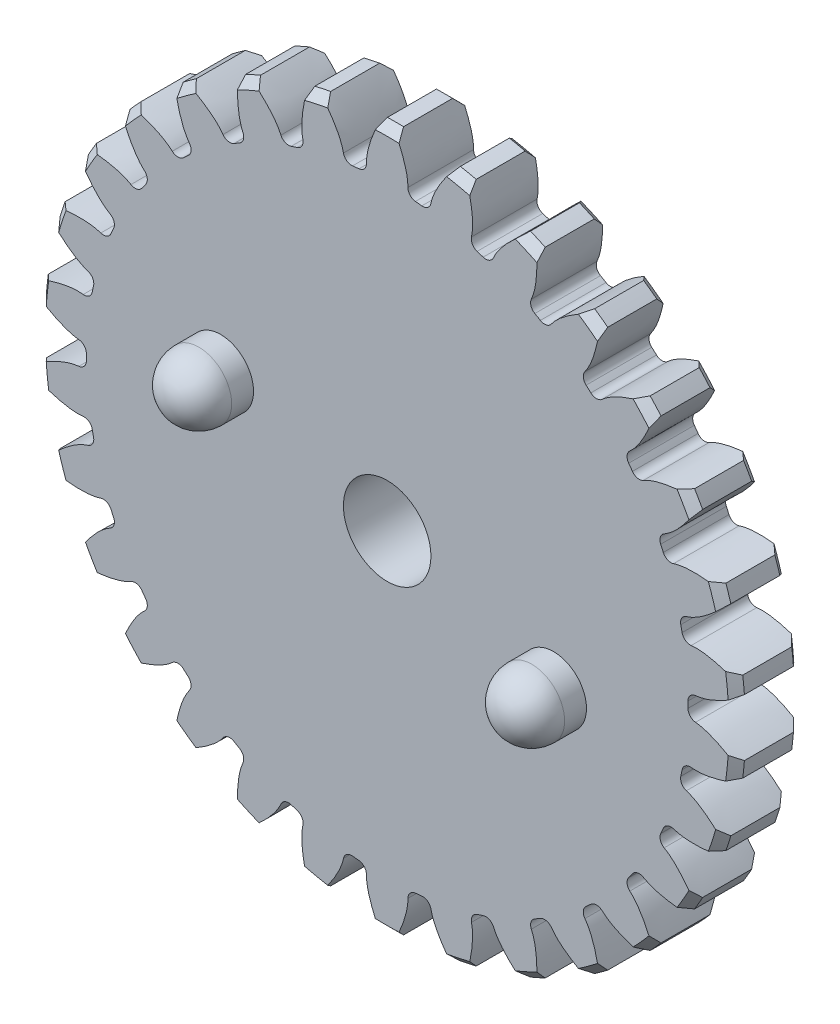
SolidWorks part; units mm, degrees
ref_plane "Plan1" through (0, 0, 0) normal (0, 0, 1) x (1, 0, 0)
ref_plane "Plan2" through (0, 0, 0) normal (0, 1, 0) x (1, 0, 0)
ref_plane "Plan3" through (0, 0, 0) normal (1, 0, 0) x (0, 0, -1)
sketch "Dent" plane through (0, 0, 0) normal (0, 0, 1) x (1, 0, 0)
  line L1 (-0.1845, 6.0656) -> (0, 5.5586)
  line L3 (0, 8) -> (0, -8) construction
  line L4 (0, 0) -> (0.1845, 7.9979) construction
  line L5 (0.3927, 7.4897) -> (-0.3927, 7.4897) construction
  line L6 (0.4739, 7.0317) -> (-0.4739, 7.0317) construction
  line L7 (-0.25, 0) -> (0.25, 0) construction
  line L9 (0.1845, 6.0656) -> (0, 5.5586)
  line L11 (0, 0) -> (0.3927, 7.4897) construction
  line L12 (0, 0) -> (0.4739, 7.0317) construction
  circle A0 centre (0, 0) radius 7.5 construction
  circle A1 centre (0, 0) radius 8 construction
  arc A2 (0.1845, 7.9979) -> (-0.1845, 7.9979) centre (0, 0) ccw
  circle A3 centre (0, 0) radius 7.0477 construction
  point P2 (-0.3927, 7.4897)
  point P3 (-0.4739, 7.0317)
  point P19 (0.3927, 7.4897)
  point P20 (0.4739, 7.0317)
sketch "Esquisse2" plane through (0, 0, 0) normal (0, 0, 1) x (1, 0, 0)
  circle A0 centre (0, 0) radius 6.875
extrude "Base-Extrusion" add sketch "Esquisse2" against normal blind 1.5
extrude "Boss.-Extru.1" add sketch "Dent" against normal blind 1.5
fillet "Congé1" radius 0.19 4 edges at (0.4582, 6.8597, -0.75) (-0.4588, 6.8597, -0.75)
chamfer "Chanfrein1" distance 0.19 angle 45 4 edges at (0, 8, -1.5) (0, 8, 0)
pattern_circular "Répétition circulaire1" count 30 over 360 of "Congé1", "Boss.-Extru.1", "Chanfrein1"
sketch "Esquisse3" plane through (0, 0, 0) normal (0, 0, 1) x (1, 0, 0)
  circle A0 centre (0, 0) radius 1
  dimension "D1" = 2
extrude "Enlèv. mat.-Extru.1" cut sketch "Esquisse3" against normal through all
sketch "Esquisse4" plane through (0, 0, 0) normal (0, 0, 1) x (1, 0, 0)
  line L0 (-7.6064, 2.4715) -> (10.4409, -3.3925) construction
  line L1 (-7.5494, 2.647) -> (-7.6634, 2.296) construction
  line L2 (0, 0) -> (1.5766, 4.8522) construction
  circle A1 centre (-3.8042, 1.2361) radius 0.75
  circle A2 centre (3.8042, -1.2361) radius 0.75
  dimension "D1" = 1.5
  dimension "D2" = 8
extrude "Extrusion1" add sketch "Esquisse4" along normal blind 1.25
fillet "Congé2" radius 0.75 2 edges at (4.5542, -1.2361, 1.25) (-3.0542, 1.2361, 1.25)
equation "\"Dp@Dent\" = \"Module@Dent\"*\"Nbr de dents@Répétition circulaire1\" "
equation "\"Dt@Dent\" = \"Module@Dent\"*(\"Nbr de dents@Répétition circulaire1\"+2)"
equation "\"Dpied@Esquisse2\" = \"Dp@Dent\"-(2.5*\"Module@Dent\")"
equation "\"Db@Dent\" = \"Dp@Dent\"*cos(\"Angle de pression@Dent\"*pi/180)"
equation "\"Ep au primitif@Dent\" =  (pi*\"Dp@Dent\"/2)/\"Nbr de dents@Répétition circulaire1\""
equation "\"D3@Dent\"=atn((Sin((sqr(((\"Dt@Dent\"/\"Db@Dent\")^2)-1))) -((sqr(((\"Dt@Dent\"/\"Db@Dent\")^2)-1)) * Cos((sqr(((\"Dt@Dent\"/\"Db@Dent\")^2)-1)))))/(Cos((sqr(((\"Dt@Dent\"/\"Db@Dent\")^2)-1))) +((sqr(((\"Dt@Dent\"/\"Db@"
equation "\"D4@Dent\"=atn((Sin((sqr(((\"Dp@Dent\"/\"Db@Dent\")^2)-1))) -((sqr(((\"Dp@Dent\"/\"Db@Dent\")^2)-1)) * Cos((sqr(((\"Dp@Dent\"/\"Db@Dent\")^2)-1)))))/(Cos((sqr(((\"Dp@Dent\"/\"Db@Dent\")^2)-1))) +((sqr(((\"Dp@Dent\"/\"Db@"
equation "\"D1@Congé1\" = \"Module@Dent\"*0.38"
equation "\"D1@Chanfrein1\" = \"Module@Dent\"*0.38"
equation "\"D1@Base-Extrusion\" = \"Epaisseur@Boss.-Extru.1\""
